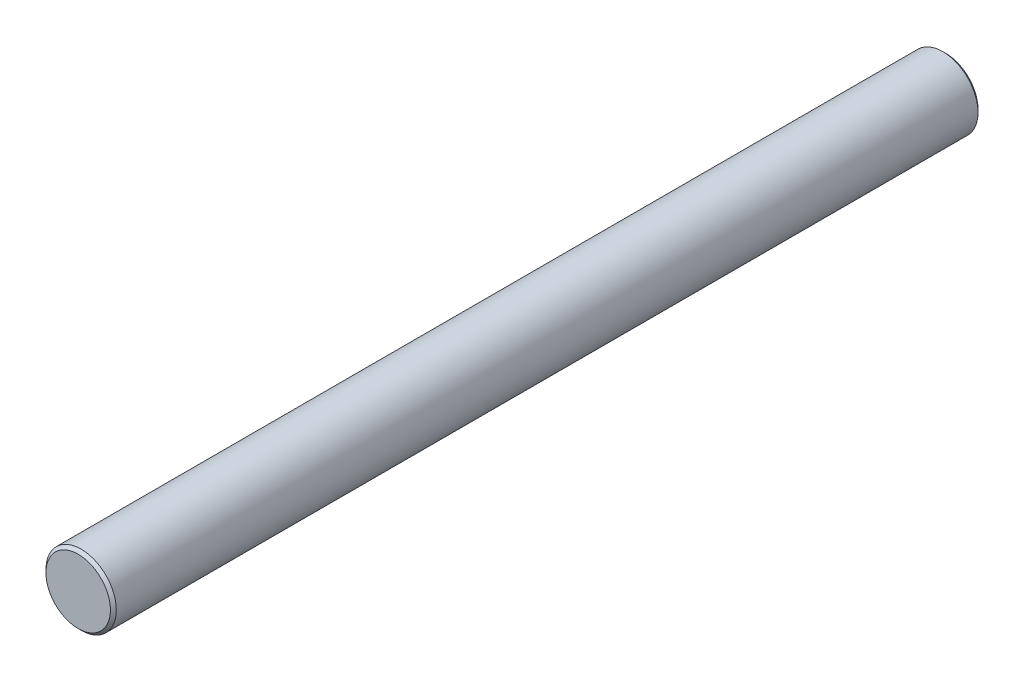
SolidWorks part; units mm, degrees
ref_plane "Спереди" through (0, 0, 0) normal (0, 0, 1) x (1, 0, 0)
ref_plane "Сверху" through (0, 0, 0) normal (0, 1, 0) x (1, 0, 0)
ref_plane "Справа" through (0, 0, 0) normal (1, 0, 0) x (0, 0, -1)
sketch "Эскиз1" plane through (0, 0, 0) normal (0, 0, 1) x (1, 0, 0)
  circle A0 centre (0, 0) radius 3
  dimension "D1" = 6
extrude "Бобышка-Вытянуть1" add sketch "Эскиз1" along normal blind 74
chamfer "Фаска1" distance 0.25 angle 45 2 edges at (3, 0, 0) (3, 0, 74)
